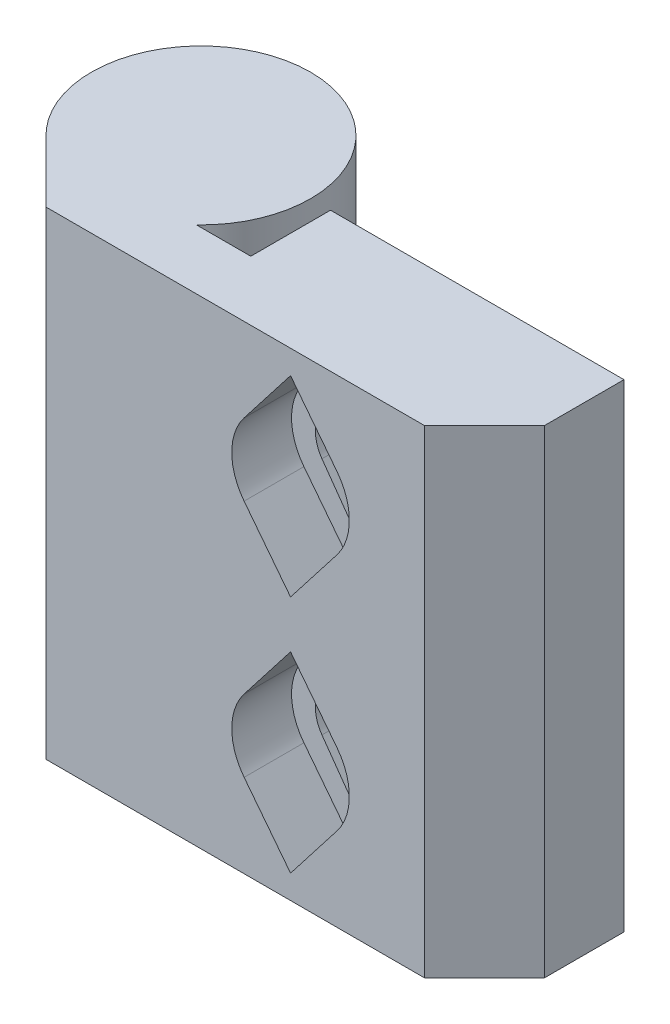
SolidWorks part; units mm, degrees
ref_plane "Front Plane" through (0, 0, 0) normal (0, 0, 1) x (1, 0, 0)
ref_plane "Top Plane" through (0, 0, 0) normal (0, 1, 0) x (1, 0, 0)
ref_plane "Right Plane" through (0, 0, 0) normal (1, 0, 0) x (0, 0, -1)
sketch "Sketch1" plane through (0, 0, 0) normal (0, 1, 0) x (1, 0, 0)
  circle A0 centre (0, 0) radius 5
  circle A1 centre (0, 0) radius 5.5
  dimension "D1" = 10
  dimension "D2" = 0.5
extrude "Boss-Extrude1" add sketch "Sketch1" along normal blind 12
sketch "Sketch2" plane through (0, 12, 0) normal (0, 1, 0) x (1, 0, 0)
  circle A0 centre (0, 0) radius 5.5 construction
  circle A1 centre (0, 0) radius 5.5
extrude "Boss-Extrude2" add sketch "Sketch2" along normal blind 12
sketch "Sketch3" plane through (0, 0, 0) normal (0, 1, 0) x (1, 0, 0)
  line L0 (-3.7749, -4) -> (21.2251, -4)
  line L1 (21.2251, -4) -> (18.2251, -7)
  line L2 (18.2251, -7) -> (-0.7749, -7)
  line L3 (-0.7749, -7) -> (-3.7749, -4)
  line L4 (0, 0) -> (-3.7749, -4) construction
  line L5 (0, 0) -> (0, -5.5) construction
  circle A1 centre (0, 0) radius 5.5 construction
  dimension "D1" = 25
  dimension "D2" = 3
  dimension "D3" = 45
  dimension "D4" = 45
  dimension "D5" = 1.5
extrude "Boss-Extrude3" add sketch "Sketch3" along normal up to surface (24 mm away)
sketch "Sketch4" plane through (0, 0, 0) normal (0, -1, 0) x (1, 0, 0)
  circle A0 centre (0, 0) radius 5
extrude "Cut-Extrude1" cut sketch "Sketch4" against normal up to surface (12 mm away)
sketch "Sketch5" plane through (0, 0, 4) normal (0, 0, -1) x (-1, 0, 0)
  line L0 (-21.2251, 0) -> (-3.7749, 0) construction
  line L1 (-21.2251, 24) -> (-6.5, 24)
  line L2 (-21.2251, 24) -> (-21.2251, 0)
  line L3 (-21.2251, 0) -> (-6.5, 0)
  line L4 (-6.5, 24) -> (-6.5, 0)
  line L5 (-5.5, 24) -> (-5.5, 0) construction
  dimension "D1" = 1
extrude "Boss-Extrude4" add sketch "Sketch5" along normal blind 4
sketch "Sketch6" plane through (0, 0, 7) normal (0, 0, 1) x (1, 0, 0)
  line L0 (-0.7749, 24) -> (-0.7749, 0) construction
  line L1 (-0.7749, 24) -> (-0.7749, 0) construction
  line L2 (-0.7749, 12) -> (18.2251, 12) construction
  line L3 (18.2251, 24) -> (18.2251, 0) construction
  line L4 (11.4951, 18) -> (11.4951, 12) construction
  line L5 (21.2251, 24) -> (21.2251, 0) construction
  line L6 (6.5, 0) -> (6.5, 24) construction
  line L7 (9.1652, 19.8095) -> (11.4951, 22.8095)
  line L8 (11.4951, 22.8095) -> (13.825, 19.8095)
  line L9 (11.4951, 18) -> (8.5451, 18) construction
  line L10 (11.4951, 18) -> (11.4951, 22.8095) construction
  line L11 (9.1652, 16.1905) -> (11.4951, 13.1905)
  line L12 (11.4951, 13.1905) -> (13.825, 16.1905)
  line L13 (11.4951, 10.8095) -> (13.825, 7.8095)
  line L14 (9.1652, 7.8095) -> (11.4951, 10.8095)
  line L15 (9.1652, 4.1905) -> (11.4951, 1.1905)
  line L16 (11.4951, 1.1905) -> (13.825, 4.1905)
  arc A0 (9.1652, 19.8095) -> (9.1652, 16.1905) centre (11.4951, 18) ccw
  arc A1 (13.825, 16.1905) -> (13.825, 19.8095) centre (11.4951, 18) ccw
  arc A2 (9.1652, 4.1905) -> (9.1652, 7.8095) centre (11.4951, 6) cw
  arc A3 (13.825, 7.8095) -> (13.825, 4.1905) centre (11.4951, 6) cw
  dimension "D1" = 5.9
  dimension "D4" = 4.9951
  dimension "D2" = 6
  dimension "D3" = 9.73
  dimension "D5" = 3
  dimension "D6" = 52.166
extrude "Cut-Extrude2" cut sketch "Sketch6" against normal blind 3
sketch "Sketch7" plane through (0, 0, 4) normal (0, 0, 1) x (1, 0, 0)
  line L0 (-0.7749, 12) -> (18.2251, 12) construction
  line L1 (-0.7749, 24) -> (-0.7749, 0) construction
  line L2 (18.2251, 24) -> (18.2251, 0) construction
  line L3 (9.7451, 18) -> (11.4951, 18) construction
  line L4 (10.0699, 19.0156) -> (11.4951, 21.0156)
  line L5 (11.4951, 21.0156) -> (12.9203, 19.0156)
  line L6 (11.4951, 18) -> (11.4951, 21.0156) construction
  line L7 (11.4951, 14.9844) -> (12.9203, 16.9844)
  line L8 (10.0699, 16.9844) -> (11.4951, 14.9844)
  line L9 (10.0699, 7.0156) -> (11.4951, 9.0156)
  line L10 (11.4951, 9.0156) -> (12.9203, 7.0156)
  line L11 (11.4951, 2.9844) -> (12.9203, 4.9844)
  line L12 (10.0699, 4.9844) -> (11.4951, 2.9844)
  arc A0 (10.0699, 19.0156) -> (10.0699, 16.9844) centre (11.4951, 18) ccw
  arc A1 (12.9203, 16.9844) -> (12.9203, 19.0156) centre (11.4951, 18) ccw
  arc A2 (10.0699, 4.9844) -> (10.0699, 7.0156) centre (11.4951, 6) cw
  arc A3 (12.9203, 7.0156) -> (12.9203, 4.9844) centre (11.4951, 6) cw
  dimension "D1" = 3.5
  dimension "D2" = 2
  dimension "D3" = 54.527
extrude "Cut-Extrude3" cut sketch "Sketch7" against normal up to next
sketch "Sketch8" [suppressed] plane through (0, 24, 0) normal (0, 1, 0) x (1, 0, 0)
  line L0 (21.2251, 0) -> (21.2251, 6.5)
  line L1 (21.2251, 6.5) -> (0, 6.5)
  line L2 (0, 6.5) -> (0, 5.5)
  line L3 (6.5, 0) -> (21.2251, 0) construction
  line L4 (6.5, 0) -> (6.5, -4) construction
  line L5 (6.5, -4) -> (3.7749, -4) construction
  line L6 (6.5, 0) -> (21.2251, 0)
  line L7 (6.5, 0) -> (6.5, -4)
  line L8 (6.5, -4) -> (3.7749, -4)
  arc A0 (3.7749, -4) -> (-3.7749, -4) centre (0, 0) ccw construction
  arc A1 (3.7749, -4) -> (0, 5.5) centre (0, 0) ccw
  dimension "D1" = 1
extrude "Boss-Extrude6" [suppressed] add sketch "Sketch8" against normal up to surface (24 mm away)
sketch "Sketch9" [suppressed] plane through (0, 0, 0) normal (0, 0, 1) x (1, 0, 0)
  line L0 (10.0699, 4.9844) -> (11.4951, 2.9844) construction
  line L1 (11.4951, 2.9844) -> (12.9203, 4.9844) construction
  line L2 (12.9203, 7.0156) -> (11.4951, 9.0156) construction
  line L3 (11.4951, 9.0156) -> (10.0699, 7.0156) construction
  line L4 (10.0699, 16.9844) -> (11.4951, 14.9844) construction
  line L5 (11.4951, 14.9844) -> (12.9203, 16.9844) construction
  line L6 (12.9203, 19.0156) -> (11.4951, 21.0156) construction
  line L7 (11.4951, 21.0156) -> (10.0699, 19.0156) construction
  line L8 (10.0699, 4.9844) -> (11.4951, 2.9844)
  line L9 (11.4951, 2.9844) -> (12.9203, 4.9844)
  line L10 (12.9203, 7.0156) -> (11.4951, 9.0156)
  line L11 (11.4951, 9.0156) -> (10.0699, 7.0156)
  line L12 (10.0699, 16.9844) -> (11.4951, 14.9844)
  line L13 (11.4951, 14.9844) -> (12.9203, 16.9844)
  line L14 (12.9203, 19.0156) -> (11.4951, 21.0156)
  line L15 (11.4951, 21.0156) -> (10.0699, 19.0156)
  arc A0 (10.0699, 7.0156) -> (10.0699, 4.9844) centre (11.4951, 6) ccw construction
  arc A1 (12.9203, 4.9844) -> (12.9203, 7.0156) centre (11.4951, 6) ccw construction
  arc A2 (12.9203, 16.9844) -> (12.9203, 19.0156) centre (11.4951, 18) ccw construction
  arc A3 (10.0699, 19.0156) -> (10.0699, 16.9844) centre (11.4951, 18) ccw construction
  arc A4 (10.0699, 7.0156) -> (10.0699, 4.9844) centre (11.4951, 6) ccw
  arc A5 (12.9203, 4.9844) -> (12.9203, 7.0156) centre (11.4951, 6) ccw
  arc A6 (12.9203, 16.9844) -> (12.9203, 19.0156) centre (11.4951, 18) ccw
  arc A7 (10.0699, 19.0156) -> (10.0699, 16.9844) centre (11.4951, 18) ccw
extrude "Cut-Extrude4" [suppressed] cut sketch "Sketch9" against normal up to next
